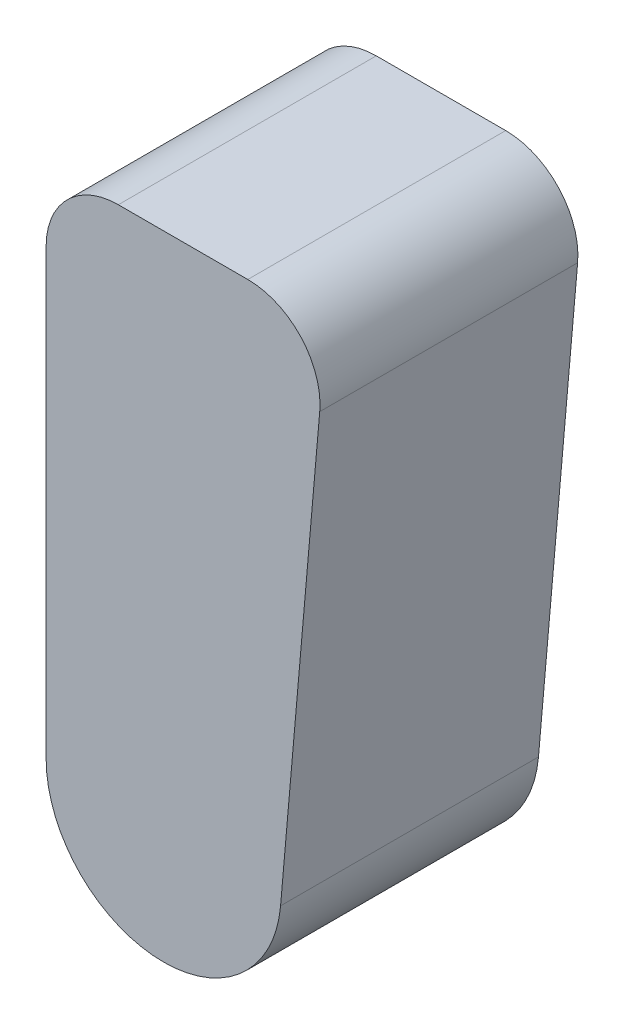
SolidWorks part; units mm, degrees
ref_plane "Plan de face" through (0, 0, 0) normal (0, 0, 1) x (1, 0, 0)
ref_plane "Plan de dessus" through (0, 0, 0) normal (0, 1, 0) x (1, 0, 0)
ref_plane "Plan de droite" through (0, 0, 0) normal (1, 0, 0) x (0, 0, -1)
sketch "Esquisse2" plane through (0, 0, 0) normal (0, 0, 1) x (1, 0, 0)
  line L0 (-11.3846, 50) -> (15.8026, 50)
  line L2 (-11.3846, 25) -> (13.6154, 25) construction
  line L3 (-11.3846, 50) -> (-11.3846, 0)
  line L4 (13.6154, 25) -> (23.5773, 24.1284) construction
  line L5 (15.8026, 50) -> (25.8408, 50) construction
  line L6 (15.8026, 50) -> (11.3413, -0.9922)
  line L7 (25.8408, 50) -> (20.4703, -11.3846) construction
  line L8 (20.4703, -11.3846) -> (10.4321, -11.3846) construction
  line L9 (10.4321, -11.3846) -> (11.3413, -0.9922) construction
  line L10 (-11.3846, 50) -> (-21.3846, 50) construction
  line L11 (-21.3846, 50) -> (-21.3846, -11.3846) construction
  line L12 (-21.3846, -11.3846) -> (-11.3846, -11.3846) construction
  line L13 (-11.3846, -11.3846) -> (-11.3846, 0) construction
  line L14 (25.8408, 50) -> (26.7157, 60) construction
  line L15 (26.7157, 60) -> (-21.3846, 60) construction
  line L16 (-21.3846, 60) -> (-21.3846, 50) construction
  line L17 (20.4703, -11.3846) -> (19.5954, -21.3846) construction
  line L18 (19.5954, -21.3846) -> (-21.3846, -21.3846) construction
  line L19 (-21.3846, -21.3846) -> (-21.3846, -11.3846) construction
  arc A0 (11.3413, -0.9922) -> (-11.3846, 0) centre (0, 0) cw
extrude "Boss.-Extru.1" add sketch "Esquisse2" along normal blind 25
fillet "Congé1" radius 7 2 edges at (15.8026, 50, 12.5) (-11.3846, 50, 12.5)
equation "\"D1@Boss.-Extru.2\" = \"thickness\""
equation "\"D7@Esquisse1\" = \"tool_diameter\" / 2"
equation "\"D6@Esquisse1\" = \"thickness\" / 2"
equation "\"D5@Esquisse1\" = \"thickness\" / 2"
equation "\"D1@Boss.-Extru.1\" = \"material_thickness\""
equation "\"D2@Esquisse2\"= \"material_thickness\""
equation "\"D1@Congé1\"=\"fillet\""
equation "\"tool_diameter\"=10"
equation "\"hole_clearance\"=0.1"
equation "\"material_thickness\"=25"
equation "\"clearance\"=0.1"
equation "\"outer_slot\"=0.5"
equation "\"fillet\"=7"
equation "\"D4@Esquisse2\"=\"tool_diameter\""
